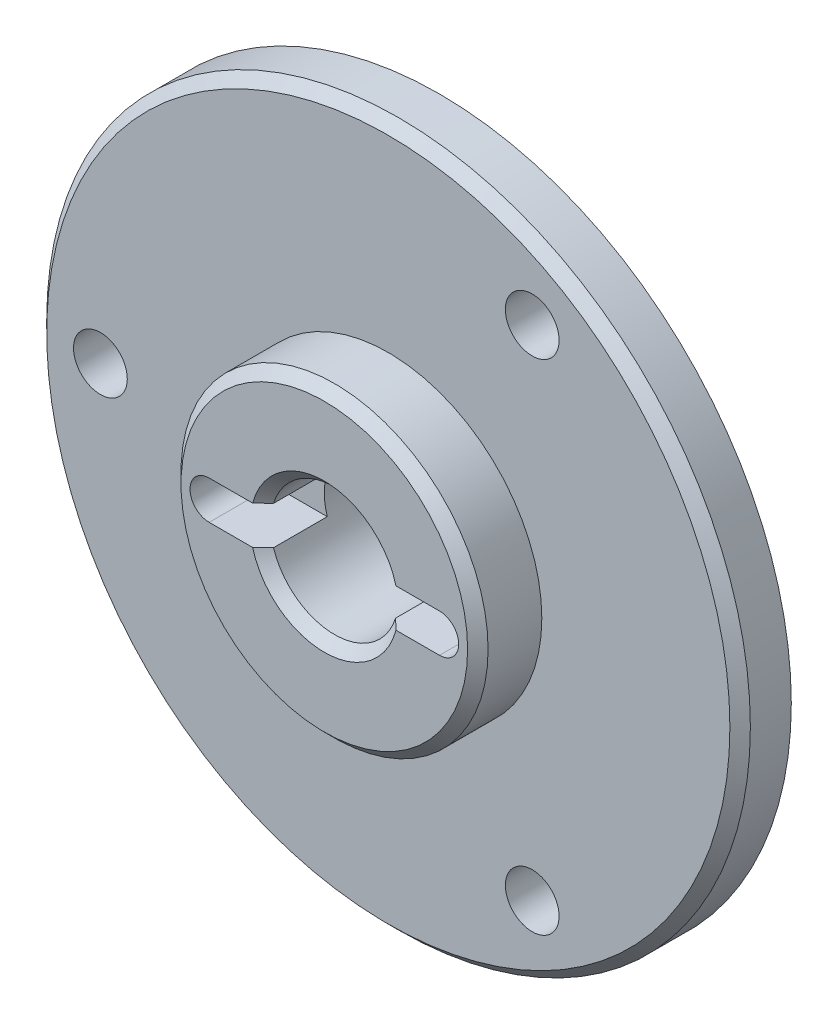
SolidWorks part; units mm, degrees
ref_plane "前视基准面" through (0, 0, 0) normal (0, 0, 1) x (1, 0, 0)
ref_plane "上视基准面" through (0, 0, 0) normal (0, 1, 0) x (1, 0, 0)
ref_plane "右视基准面" through (0, 0, 0) normal (1, 0, 0) x (0, 0, -1)
sketch "草图1" plane through (0, 0, 0) normal (0, 0, 1) x (1, 0, 0)
  circle A0 centre (0, 0) radius 27.5
  circle A1 centre (0, 0) radius 5
  dimension "D1" = 55
  dimension "D2" = 10
extrude "凸台-拉伸1" add sketch "草图1" along normal blind 4
sketch "草图2" plane through (0, 0, 0) normal (0, 0, -1) x (-1, 0, 0)
  circle A0 centre (0, 0) radius 5
  circle A1 centre (0, 0) radius 9.9
  dimension "D1" = 19.8
  dimension "D2" = 10
extrude "凸台-拉伸2" add sketch "草图2" along normal blind 12
sketch "草图3" plane through (0, 0, 4) normal (0, 0, 1) x (1, 0, 0)
  circle A0 centre (0, 0) radius 5
  circle A1 centre (0, 0) radius 12
  dimension "D1" = 24
extrude "凸台-拉伸3" add sketch "草图3" along normal blind 5
sketch "草图4" plane through (0, 0, 9) normal (0, 0, 1) x (1, 0, 0)
  line L0 (-9, 0) -> (9, 0) construction
  line L1 (-9, 1.5) -> (9, 1.5)
  line L2 (-9, -1.5) -> (9, -1.5)
  arc A0 (-9, 1.5) -> (-9, -1.5) centre (-9, 0) ccw
  arc A1 (9, -1.5) -> (9, 1.5) centre (9, 0) ccw
  point P2 (0, 0)
  dimension "D1" = 3
  dimension "D2" = 18
extrude "切除-拉伸1" cut sketch "草图4" against normal blind 5
sketch "草图5" plane through (0, 0, 0) normal (0, 0, -1) x (-1, 0, 0)
  circle A0 centre (22.5, 0) radius 2
  circle A1 centre (11.25, -19.4856) radius 2
  circle A2 centre (-11.25, -19.4856) radius 2
  circle A3 centre (-22.5, 0) radius 2
  circle A4 centre (-11.25, 19.4856) radius 2
  circle A5 centre (11.25, 19.4856) radius 2
  point P15 (0, 0)
  dimension "D1" = 4
  dimension "D3" = 6
hole_wizard "M5 螺纹孔2" positions "3D草图2" profile "草图7" tap size "M5" standard "GB"
sketch3d "3D草图2"
  point P0 (11.25, 19.4856, 0)
  point P3 (-22.5, 0, 0)
  point P6 (11.25, -19.4856, 0)
sketch "草图7" plane through (11.25, 19.4856, 0) normal (1, 0, 0) x (0, 1, 0)
  line L0 (0, 0) -> (0, 9)
  line L1 (0, 9) -> (2.1, 9)
  line L2 (2.1, 9) -> (2.1, 0.55)
  line L3 (2.1, 0.55) -> (2.65, 0)
  line L5 (2.65, 0) -> (0, 0)
  line L6 (-2.1, 0.55) -> (-2.65, 0) construction
  line L11 (0, -6.35) -> (0, 107.95) construction
  dimension "通孔螺纹孔钻头直径" = 4.2
  dimension "通孔螺纹孔钻头深度" = 9
  dimension "近端锥形沉头孔直径" = 5.3
  dimension "近端锥形沉头孔角度" = 90
sketch "草图8" plane through (0, 0, 0) normal (0, 0, -1) x (-1, 0, 0)
  circle A0 centre (11.25, 19.4856) radius 2.4
  circle A1 centre (-22.5, 0) radius 2.4
  circle A2 centre (11.25, -19.4856) radius 2.4
  dimension "D1" = 4.8
extrude "凸台-拉伸4" add sketch "草图8" along normal blind 2.5
chamfer "倒角1" distance 0.8 angle 45 8 edges at (-13.65, -19.4856, -2.5) (20.1, 0, -2.5) (-13.65, 19.4856, -2.5) (27.5, 0, 4) (12, 0, 9) (0, -5, 9) (0, 5, 9) (-9.9, 0, -12)
